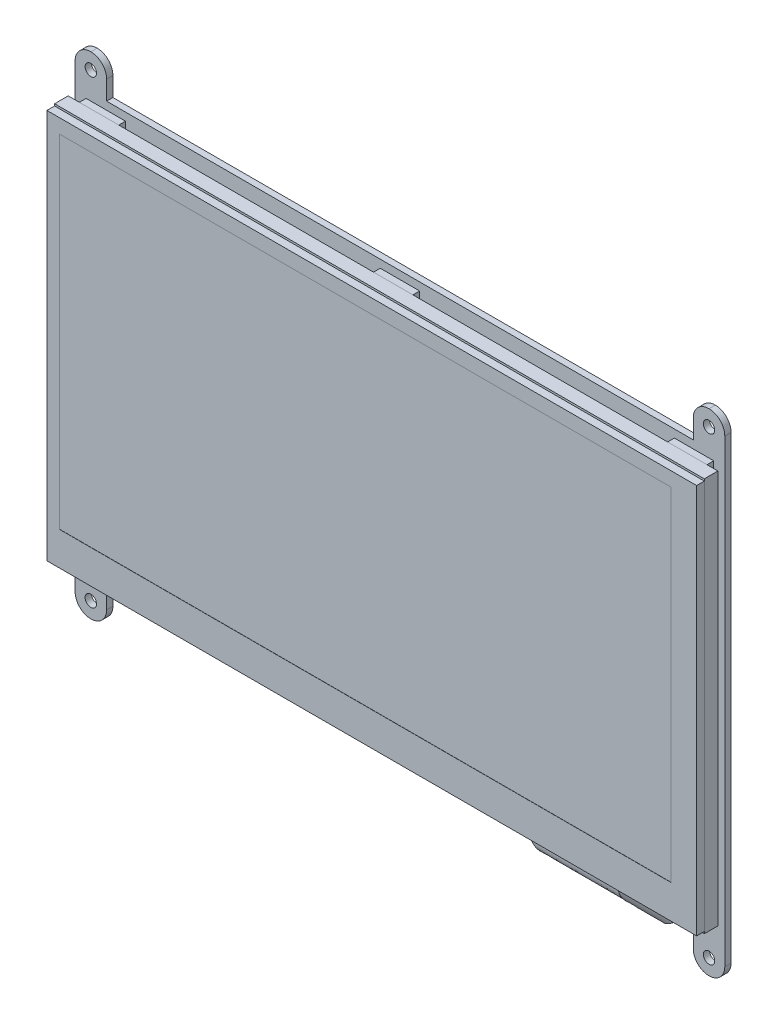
SolidWorks part; units mm, degrees
ref_plane "Front Plane" through (0, 0, 0) normal (0, 0, 1) x (1, 0, 0)
ref_plane "Top Plane" through (0, 0, 0) normal (0, 1, 0) x (1, 0, 0)
ref_plane "Right Plane" through (0, 0, 0) normal (1, 0, 0) x (0, 0, -1)
sketch "Sketch1" plane through (0, 0, 0) normal (0, 0, 1) x (1, 0, 0)
  line L0 (74.45, 62.335) -> (82.45, 62.335)
  line L1 (-82.45, 62.335) -> (-74.45, 62.335)
  line L2 (-82.45, 62.335) -> (-82.45, -62.335)
  line L3 (-82.45, -62.335) -> (-74.45, -62.335)
  line L4 (82.45, 62.335) -> (82.45, -62.335)
  line L5 (-82.45, 62.335) -> (82.45, -62.335) construction
  line L6 (-82.45, -62.335) -> (82.45, 62.335) construction
  line L7 (-82.45, 0) -> (82.45, 0) construction
  line L8 (-74.45, 62.335) -> (-74.45, 53.48)
  line L9 (-74.45, 53.48) -> (74.45, 53.48)
  line L10 (74.45, 62.335) -> (74.45, 53.48)
  line L11 (74.45, -62.335) -> (74.45, -53.48)
  line L12 (-74.45, -53.48) -> (74.45, -53.48)
  line L13 (-74.45, -62.335) -> (-74.45, -53.48)
  line L14 (74.45, -62.335) -> (82.45, -62.335)
  point P0 (0, 0)
  dimension "D1" = 164.9
  dimension "D2" = 124.67
  dimension "D3" = 53.48
  dimension "D4" = 8
  dimension "D5" = 8
extrude "PCBA" add sketch "Sketch1" along normal blind 1.6
fillet "Fillet1" radius 4 8 edges at (-82.45, 62.335, 0.8) (-74.45, 62.335, 0.8) (-82.45, -62.335, 0.8) (-74.45, -62.335, 0.8) (74.45, -62.335, 0.8) (82.45, -62.335, 0.8) (74.45, 62.335, 0.8) (82.45, 62.335, 0.8)
sketch "Sketch2" plane through (0, 0, 1.6) normal (0, 0, 1) x (1, 0, 0)
  circle A0 centre (-78.45, 58.335) radius 1.45
  circle A1 centre (78.45, 58.335) radius 1.45
  circle A2 centre (78.45, -58.335) radius 1.45
  circle A3 centre (-78.45, -58.335) radius 1.45
  dimension "D1" = 2.9
  dimension "D2" = 2.9
  dimension "D3" = 2.9
  dimension "D4" = 2.9
extrude "ScrewHole" cut sketch "Sketch2" against normal through all
ref_plane "Plane1" through (0, 0, 0) normal (0, 0, -1) x (-1, 0, 0)
sketch "Sketch4" plane through (0, 0, 0) normal (0, 0, -1) x (-1, 0, 0)
  line L0 (-510.7184, 85.5441) -> (-17.3851, 85.5441) construction
sketch "Sketch5" plane through (0, 0, 1.6) normal (0, 0, 1) x (1, 0, 0)
  line L1 (-74.45, -53.48) -> (74.45, -53.48) construction
  line L2 (-79.65, 51.48) -> (-69.65, 51.48)
  line L3 (-79.65, 51.48) -> (-79.65, -43.48)
  line L4 (-79.65, -43.48) -> (-69.65, -43.48)
  line L7 (-69.65, 51.48) -> (-69.65, -43.48)
  line L8 (74.45, 53.48) -> (-74.45, 53.48) construction
  line L9 (-82.45, 58.335) -> (-82.45, -58.335) construction
  line L10 (0, 53.48) -> (0, -53.48) construction
  line L11 (79.65, -43.48) -> (69.65, -43.48)
  line L12 (69.65, 51.48) -> (69.65, -43.48)
  line L13 (79.65, 51.48) -> (69.65, 51.48)
  line L14 (79.65, 51.48) -> (79.65, -43.48)
  line L16 (5, 51.48) -> (-5, 51.48)
  line L17 (5, 51.48) -> (5, -43.48)
  line L18 (5, -43.48) -> (-5, -43.48)
  line L19 (-5, 51.48) -> (-5, -43.48)
  line L20 (5, 51.48) -> (-5, -43.48) construction
  line L21 (5, -43.48) -> (-5, 51.48) construction
  point P16 (0, 4)
  dimension "D1" = 10
  dimension "D2" = 2
  dimension "D3" = 2.8
  dimension "D4" = 10
  dimension "D5" = 10
extrude "Tape" add sketch "Sketch5" along normal blind 1.75
sketch "Sketch6" plane through (0, 0, 3.35) normal (0, 0, 1) x (1, 0, 0)
  line L0 (-82.45, 58.335) -> (-82.45, -58.335) construction
  line L1 (-82.45, 51.52) -> (82.45, 51.52)
  line L2 (-82.45, 51.52) -> (-82.45, -48.48)
  line L3 (-82.45, -48.48) -> (82.45, -48.48)
  line L4 (82.45, 51.52) -> (82.45, -48.48)
  line L5 (82.45, -58.335) -> (82.45, 58.335) construction
  line L6 (-74.45, -53.48) -> (74.45, -53.48) construction
  dimension "D1" = 100
  dimension "D2" = 5
extrude "Backlight" add sketch "Sketch6" along normal blind 3.45 separate body
sketch "Sketch7" plane through (0, 0, 6.8) normal (0, 0, 1) x (1, 0, 0)
  line L0 (82.45, -48.48) -> (82.45, 51.52) construction
  line L1 (-82.45, 51.02) -> (82.45, 51.02)
  line L2 (-82.45, 51.02) -> (-82.45, -47.98)
  line L3 (-82.45, -47.98) -> (82.45, -47.98)
  line L4 (82.45, 51.02) -> (82.45, -47.98)
  line L5 (-82.45, 51.02) -> (82.45, -47.98) construction
  line L6 (-82.45, -47.98) -> (82.45, 51.02) construction
  line L7 (-82.45, 51.52) -> (-82.45, -48.48) construction
  line L8 (82.45, 51.52) -> (-82.45, 51.52) construction
  point P0 (0, 1.52)
  point P12 (-82.45, 1.52)
  point P16 (0, 51.52)
  dimension "D1" = 99
extrude "LCDnTouch" add sketch "Sketch7" along normal blind 1.95 separate body
sketch "Sketch9" plane through (0, -47.98, 0) normal (0, -1, 0) x (1, 0, 0)
  line L1 (-82.45, 6.8) -> (82.45, 6.8) construction
  line L2 (75.98, 8.55) -> (62.28, 8.55)
  line L3 (75.98, 8.55) -> (75.98, 8.35)
  line L4 (75.98, 8.35) -> (62.28, 8.35)
  line L5 (62.28, 8.55) -> (62.28, 8.35)
  line L6 (37.98, 6.8) -> (61.38, 6.8) construction
  line L7 (37.98, 6.8) -> (37.98, 7) construction
  line L8 (37.98, 7) -> (61.38, 7) construction
  line L9 (61.38, 6.8) -> (61.38, 7) construction
  line L10 (82.45, 8.75) -> (82.45, 6.8) construction
  line L11 (-82.45, 8.75) -> (82.45, 8.75) construction
  point P10 (75.98, 8.45)
  dimension "D1" = 0.2
  dimension "D2" = 0.2
  dimension "D3" = 6.47
  dimension "D4" = 13.7
  dimension "D5" = 0.9
  dimension "D6" = 23.4
  dimension "D7" = 0.2
sketch "Sketch11" plane through (82.45, 0, 0) normal (1, 0, 0) x (0, 0, -1)
  line L0 (-8.55, -47.98) -> (-8.35, -47.98) construction
  line L1 (-8.75, -47.98) -> (-6.8, -47.98) construction
  line L2 (-1.6, -58.335) -> (-1.6, 58.335) construction
  spline S0 degree 1 poles (-8.45, -47.98) (-7.775, -47.98) knots 0 0 1 1
  spline S1 degree 3 poles (-8.45, -47.98) (-6.7998, -53.8145) (-1.5822, -53.5503) (-1.6, -46.0786) knots 0 0 0 0 1 1 1 1
sweep "Sweep1" add profiles "Sketch9" path "Sketch11"
sketch "Sketch13" plane through (0, -47.98, 0) normal (0, -1, 0) x (1, 0, 0)
  line L0 (-82.45, 6.8) -> (82.45, 6.8) construction
  line L1 (38.48, 7) -> (61.38, 7)
  line L2 (38.48, 7) -> (38.48, 6.8)
  line L3 (38.48, 6.8) -> (61.38, 6.8)
  line L4 (61.38, 7) -> (61.38, 6.8)
  line L5 (62.28, 8.55) -> (62.28, 1.6) construction
  line L6 (75.98, 1.6) -> (75.98, 8.55) construction
  dimension "D1" = 0.2
  dimension "D2" = 0.9
  dimension "D3" = 37.5
sketch "Sketch14" plane through (82.45, 0, 0) normal (1, 0, 0) x (0, 0, -1)
  line L0 (-7, -47.98) -> (-6.8, -47.98) construction
  spline S0 degree 3 poles (-6.9, -47.98) (-7.366, -49.0795) (-6.961, -52.987) (-1.7751, -52.7026) (-1.6, -46.0786) knots 0 0 0 0 0.302587 1 1 1 1
  spline S1 degree 3 poles (-8.35, -47.98) (-7.5212, -50.8821) (-5.8257, -52.1974) (-2.9537, -51.6418) (-1.681, -49.7761) (-1.6963, -46.0516) knots 0 0 0 0 0.5 0.5 1 1 1 1 construction
sweep "Sweep2" add profiles "Sketch13" path "Sketch14"
sketch "Sketch15" plane through (0, 0, 1.6) normal (0, 0, 1) x (1, 0, 0)
  line L0 (38.48, -48.5574) -> (40.98, -52.3283)
  line L1 (38.48, -47.444) -> (38.48, -52.1489) construction
  line L2 (40.98, -52.3283) -> (70.98, -52.3283)
  line L3 (70.98, -52.3283) -> (75.98, -48.5574)
  line L4 (75.98, -52.1488) -> (75.98, -47.7688) construction
  line L5 (75.98, -48.5574) -> (75.98, -53.1388)
  line L6 (75.98, -53.1388) -> (38.2487, -53.1388)
  line L7 (38.2487, -53.1388) -> (38.2487, -48.5574)
  line L8 (38.2487, -48.5574) -> (38.48, -48.5574)
  dimension "D1" = 30
  dimension "D2" = 5
extrude "Cut-Extrude3" cut sketch "Sketch15" along normal blind 31.65
sketch "Sketch16" plane through (0, 0, 8.75) normal (0, 0, 1) x (1, 0, 0)
  line L0 (-82.45, -47.98) -> (82.45, -47.98) construction
  line L1 (-79.25, 47.42) -> (75.95, 47.42)
  line L2 (-79.25, 47.42) -> (-79.25, -39.48)
  line L3 (-79.25, -39.48) -> (75.95, -39.48)
  line L4 (75.95, 47.42) -> (75.95, -39.48)
  line L5 (82.45, 51.02) -> (-82.45, 51.02) construction
  line L6 (82.45, -47.98) -> (82.45, 51.02) construction
  line L7 (-82.45, 51.02) -> (-82.45, -47.98) construction
  dimension "D1" = 8.5
  dimension "D2" = 3.6
  dimension "D3" = 6.5
  dimension "D4" = 3.2
extrude "Cut-Extrude4" cut sketch "Sketch16" against normal blind 0.05
